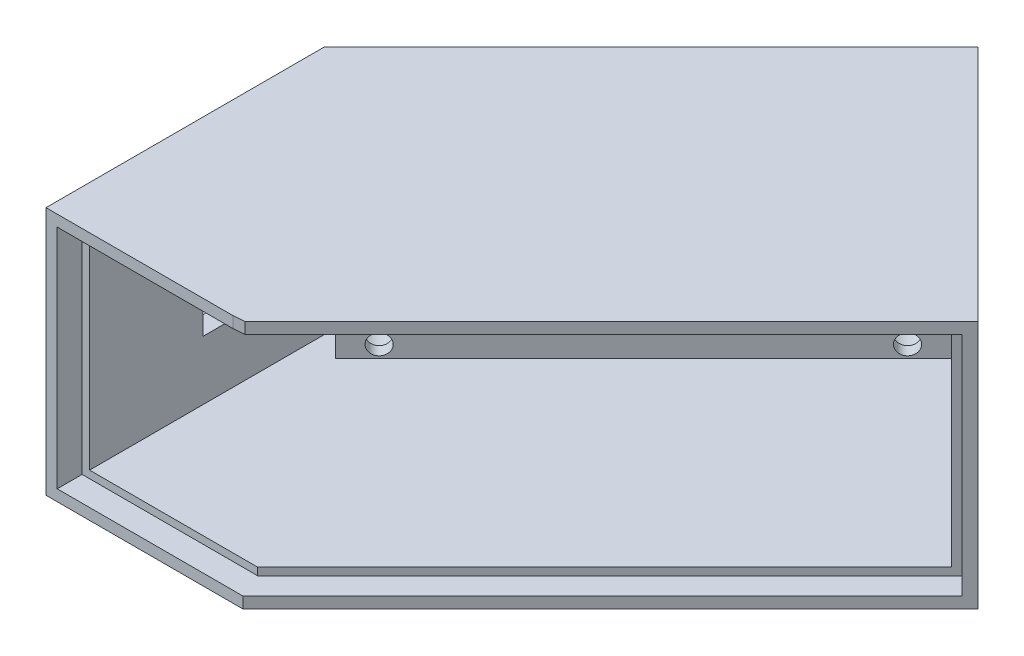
SolidWorks part; units mm, degrees
ref_plane "Спереди" through (0, 0, 0) normal (0, 0, 1) x (1, 0, 0)
ref_plane "Сверху" through (0, 0, 0) normal (0, 1, 0) x (1, 0, 0)
ref_plane "Справа" through (0, 0, 0) normal (1, 0, 0) x (0, 0, -1)
sketch "Sketch1" plane through (0, 0, 0) normal (0, 1, 0) x (1, 0, 0)
  line L0 (-43.3594, -5.3943) -> (-43.3594, 35.3164)
  line L1 (-43.3594, 35.3164) -> (9.115, 87.7907)
  line L2 (9.115, 87.7907) -> (44.4704, 52.4354)
  line L3 (44.4704, 52.4354) -> (-13.3594, -5.3943)
  line L4 (-13.3594, -5.3943) -> (-43.3594, -5.3943)
  dimension "D1" = 74.21
  dimension "D3" = 135
  dimension "D4" = 30
  dimension "D5" = 50
extrude "Boss-Extrude1" add sketch "Sketch1" along normal blind 40
shell "Shell1" thickness 3
sketch "Sketch6" plane through (-3.9825, 0, -3.9825) normal (0.7071, 0, 0.7071) x (0.7071, 0, -0.7071)
  line L0 (-13.2609, 38.2) -> (66.7227, 38.2)
  line L1 (-13.2609, 40) -> (-13.2609, 37) construction
  line L2 (66.7227, 38.2) -> (66.7227, 1.8)
  line L3 (66.7227, 1.8) -> (-13.2609, 1.8)
  line L4 (-13.2609, 3) -> (-13.2609, 0) construction
  line L5 (-13.2609, 40) -> (68.5227, 40) construction
  line L6 (-13.2609, 0) -> (68.5227, 0) construction
  line L7 (68.5227, 40) -> (68.5227, 0) construction
  line L8 (-13.2609, 38.2) -> (-13.2609, 40)
  line L9 (-13.2609, 40) -> (68.5227, 40)
  line L10 (68.5227, 40) -> (68.5227, 0)
  line L11 (68.5227, 0) -> (-13.2609, 0)
  line L12 (-13.2609, 0) -> (-13.2609, 1.8)
  dimension "D1" = 1.8
  dimension "D2" = 1.8
  dimension "D3" = 1.8
extrude "Boss-Extrude2" add sketch "Sketch6" along normal blind 4
sketch "Sketch7" plane through (0, 0, 5.3943) normal (0, 0, 1) x (1, 0, 0)
  line L0 (-13.3594, 1.8) -> (-41.5594, 1.8)
  line L1 (-41.5594, 1.8) -> (-41.5594, 38.2)
  line L2 (-41.5594, 38.2) -> (-13.3594, 38.2)
  line L3 (-43.3594, 40) -> (-43.3594, 0) construction
  line L4 (-13.3594, 38.2) -> (-13.3594, 40)
  line L5 (-13.3594, 40) -> (-43.3594, 40)
  line L6 (-43.3594, 40) -> (-43.3594, 0)
  line L7 (-43.3594, 0) -> (-13.3594, 0)
  line L8 (-13.3594, 0) -> (-13.3594, 1.8)
  dimension "D1" = 1.8
extrude "Boss-Extrude3" add sketch "Sketch7" along normal blind 4
sketch "Sketch8" plane through (0, 0, 0) normal (0, -1, 0) x (1, 0, 0)
  line L0 (-13.3594, 9.3943) -> (-11.7025, 9.3943)
  line L1 (-11.7025, 9.3943) -> (-10.5309, 8.2228)
  line L2 (-10.5309, 8.2228) -> (-13.3594, 5.3943)
  line L3 (-13.3594, 5.3943) -> (-13.3594, 9.3943)
  line L4 (-10.5309, 8.2228) -> (47.2988, -49.607) construction
extrude "Boss-Extrude4" add sketch "Sketch8" against normal up to surface (1.8 mm away)
sketch "Sketch9" plane through (0, 40, 0) normal (0, 1, 0) x (1, 0, 0)
  line L0 (-13.3594, -5.3943) -> (-10.5309, -8.2228)
  line L1 (-10.5309, -8.2228) -> (-11.5537, -9.2455)
  line L2 (-11.5537, -9.2455) -> (-13.3594, -9.3943)
  line L3 (-13.3594, -9.3943) -> (-13.3594, -5.3943)
  line L4 (47.2988, 49.607) -> (-10.5309, -8.2228) construction
extrude "Boss-Extrude5" add sketch "Sketch9" against normal up to surface (1.8 mm away)
sketch "Sketch10" plane through (-37.2165, 0, -37.2165) normal (0.7071, 0, 0.7071) x (0.7071, 0, -0.7071)
  line L0 (65.5227, 20) -> (-4.4446, 20) construction
  line L1 (65.5227, 37) -> (65.5227, 3) construction
  line L2 (-4.4446, 37) -> (-4.4446, 3) construction
  line L3 (60.5227, 35) -> (60.5227, 5) construction
  line L4 (68.5227, 40) -> (68.5227, 0) construction
  line L5 (0.5227, 35) -> (0.5227, 5) construction
  line L6 (60.5227, 35) -> (0.5227, 35) construction
  circle A0 centre (60.5227, 35) radius 1.6
  circle A1 centre (60.5227, 5) radius 1.6
  circle A2 centre (0.5227, 35) radius 1.6
  circle A3 centre (0.5227, 5) radius 1.6
  point P8 (60.5227, 20)
  point P11 (68.5227, 20)
  dimension "D3" = 3.2
  dimension "D1" = 30
  dimension "D2" = 8
  dimension "D4" = 60
extrude "Cut-Extrude6" cut sketch "Sketch10" against normal through all
sketch "Sketch11" plane through (-40.3594, 0, 0) normal (1, 0, 0) x (0, 0, -1)
  line L0 (19.2076, 37) -> (19.2076, 3) construction
  line L1 (34.0737, 37) -> (-5.3943, 37) construction
  line L2 (34.0737, 3) -> (-5.3943, 3) construction
  line L4 (12.8076, 12.5) -> (25.6076, 12.5)
  line L5 (12.8076, 12.5) -> (12.8076, 27.5)
  line L6 (12.8076, 27.5) -> (25.6076, 27.5)
  line L7 (25.6076, 12.5) -> (25.6076, 27.5)
  line L8 (12.8076, 12.5) -> (25.6076, 27.5) construction
  line L9 (12.8076, 27.5) -> (25.6076, 12.5) construction
  point P6 (19.2076, 20)
  dimension "D1" = 15
  dimension "D2" = 12.8
extrude "Cut-Extrude7" cut sketch "Sketch11" against normal up to surface (3 mm away)
sketch "Sketch12" plane through (-37.2165, 0, -37.2165) normal (0.7071, 0, 0.7071) x (0.7071, 0, -0.7071)
  line L0 (65.5227, 37) -> (-4.4446, 3) construction
  line L1 (-4.4446, 37) -> (-4.4446, 3) construction
  line L3 (65.5227, 3) -> (-4.4446, 3)
  line L4 (65.5227, 3) -> (65.5227, 37)
  line L5 (65.5227, 37) -> (-4.4446, 37)
  line L6 (-4.4446, 3) -> (-4.4446, 37)
  line L7 (65.5227, 3) -> (-4.4446, 37) construction
  line L8 (65.5227, 37) -> (-4.4446, 3) construction
  circle A0 centre (0.5227, 35) radius 1.6
  circle A1 centre (60.5227, 35) radius 1.6
  circle A2 centre (60.5227, 5) radius 1.6
  circle A3 centre (0.5227, 5) radius 1.6
  point P5 (30.539, 20)
extrude "Boss-Extrude7" add sketch "Sketch12" along normal blind 6
sketch "Sketch13" plane through (-39.3379, 0, -39.3379) normal (-0.7071, 0, -0.7071) x (-0.7071, 0, 0.7071)
  circle A0 centre (-0.5227, 35) radius 3.1
  circle A1 centre (-0.5227, 5) radius 3.1
  circle A2 centre (-60.5227, 5) radius 3.1
  circle A3 centre (-60.5227, 35) radius 3.1
  dimension "D1" = 6.2
extrude "Cut-Extrude9" cut sketch "Sketch13" against normal blind 7
sketch "Sketch14" plane through (-32.9739, 0, -32.9739) normal (0.7071, 0, 0.7071) x (0.7071, 0, -0.7071)
  line L0 (-4.4446, 37) -> (65.5227, 3) construction
  line L2 (60.539, 9) -> (0.539, 9)
  line L3 (60.539, 9) -> (60.539, 31)
  line L4 (60.539, 31) -> (0.539, 31)
  line L5 (0.539, 9) -> (0.539, 31)
  line L6 (60.539, 9) -> (0.539, 31) construction
  line L7 (60.539, 31) -> (0.539, 9) construction
  point P4 (30.539, 20)
  dimension "D1" = 22
  dimension "D2" = 60
extrude "Cut-Extrude10" cut sketch "Sketch14" against normal blind 6
chamfer "Chamfer1" distance 2 angle 45 4 edges at (9.8337, 20, -75.7815) (-11.3795, 31, -54.5683) (-32.5927, 20, -33.3551) (-11.3795, 9, -54.5683)
